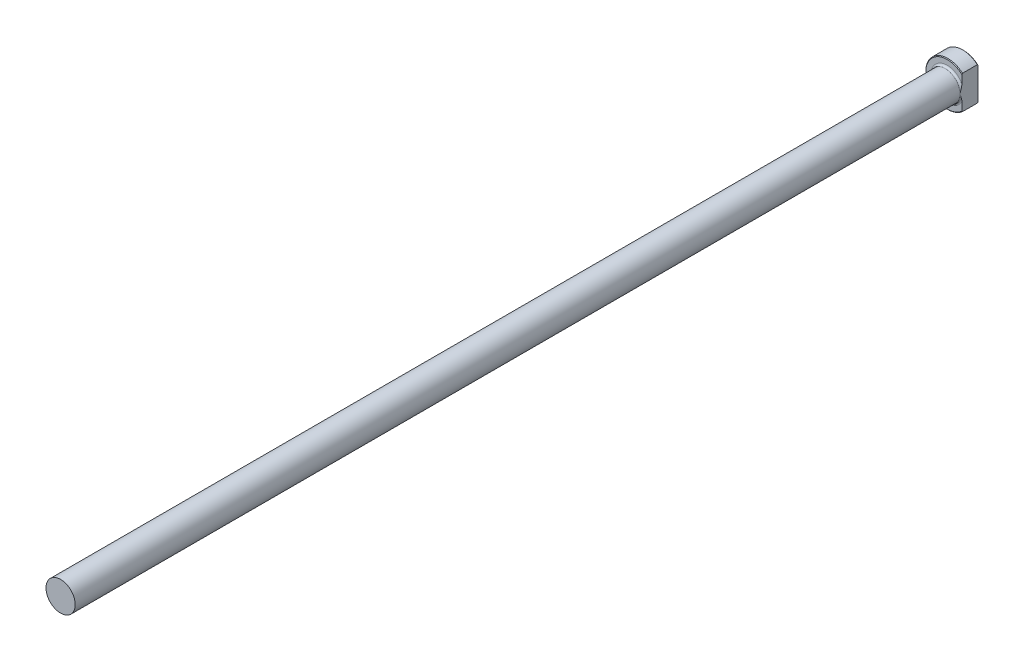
SolidWorks part; units mm, degrees
ref_plane "Front Plane" through (0, 0, 0) normal (0, 0, 1) x (1, 0, 0)
ref_plane "Top Plane" through (0, 0, 0) normal (0, 1, 0) x (1, 0, 0)
ref_plane "Right Plane" through (0, 0, 0) normal (1, 0, 0) x (0, 0, -1)
sketch "Sketch1" plane through (0, 0, 0) normal (1, 0, 0) x (0, 0, -1)
  line L0 (0, 0) -> (0, 8.7249)
  line L1 (0, 8.7249) -> (-6.35, 8.7249)
  line L2 (-6.35, 8.7249) -> (-6.35, 6.5164)
  line L3 (-7.112, 5.7544) -> (-355.6, 5.7544)
  line L4 (-355.6, 5.7544) -> (-355.6, 0)
  line L5 (-355.6, 0) -> (0, 0)
  line L6 (25.4347, 0) -> (-130.6739, 0) construction
  arc A0 (-6.35, 6.5164) -> (-7.112, 5.7544) centre (-7.112, 6.5164) cw
  dimension "D4" = 0.762
  dimension "D1" = 11.5087
  dimension "D2" = 17.4498
  dimension "D3" = 6.35
  dimension "D5" = 355.6
revolve "Revolve1" add sketch "Sketch1" angle 360 about L6
chamfer "Chamfer1" distance 0.254 angle 45 2 edges at (-8.7249, 0, 0) (-8.7249, 0, 6.35)
sketch "Sketch2" plane through (0, 0, 0) normal (0, 0, -1) x (-1, 0, 0)
  line L1 (-5.7544, 6.5583) -> (-5.7544, -6.5583)
  circle A1 centre (0, 0) radius 8.7249 construction
  circle A2 centre (0, 0) radius 5.7544 construction
  arc A5 (-5.7544, -6.5583) -> (-5.7544, 6.5583) centre (0, 0) cw
extrude "Cut-Extrude1" cut sketch "Sketch2" against normal up to next
